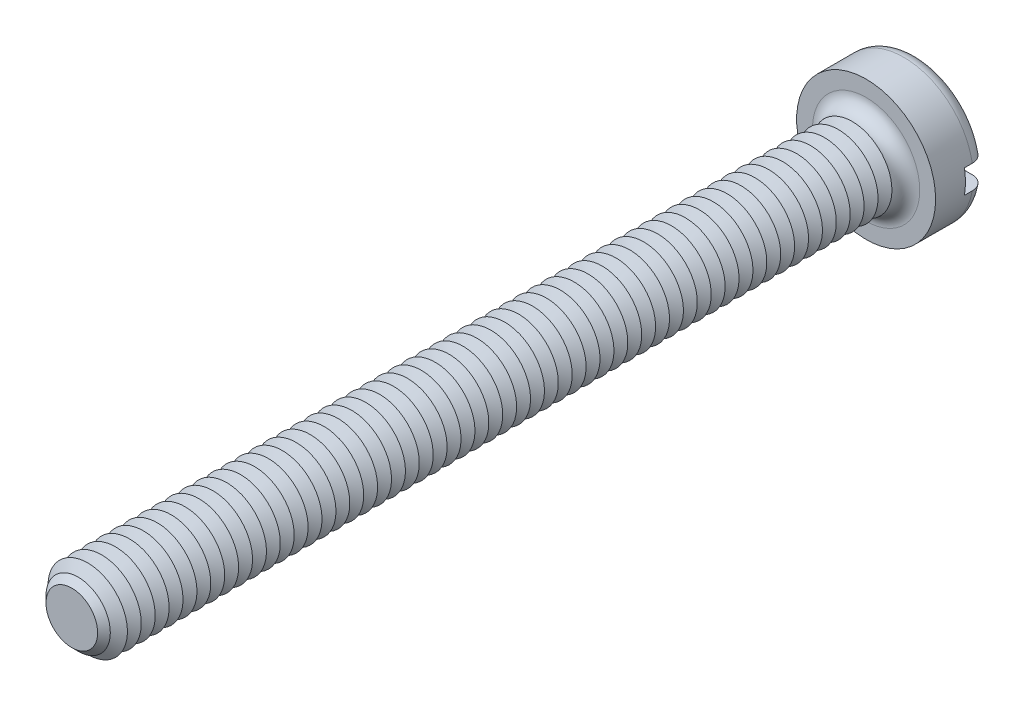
SolidWorks part; units mm, degrees
ref_plane "Front Plane" through (0, 0, 0) normal (0, 0, 1) x (1, 0, 0)
ref_plane "Top Plane" through (0, 0, 0) normal (0, 1, 0) x (1, 0, 0)
ref_plane "Right Plane" through (0, 0, 0) normal (1, 0, 0) x (0, 0, -1)
sketch "Sketch3" plane through (0, 0, 0) normal (0, 0, 1) x (1, 0, 0)
  circle A0 centre (0, 0) radius 3.5
  dimension "D1" = 7
extrude "Boss-Extrude2" add sketch "Sketch3" against normal blind 2.6
sketch "Sketch4" plane through (0, 0, 0) normal (0, 0, 1) x (1, 0, 0)
  circle A0 centre (0, 0) radius 2
  dimension "D1" = 4
extrude "Boss-Extrude3" add sketch "Sketch4" along normal blind 40
fillet "Fillet1" radius 0.7 2 edges at (3.5, 0, -2.6) (2, 0, 0)
chamfer "Chamfer1" distance 0.7 angle 45 1 edges at (2, 0, 40)
sketch "Sketch5" plane through (0, 0, 0) normal (1, 0, 0) x (0, 0, -1)
  line L0 (1.6944, 0) -> (-7.6738, 0) construction
sketch "Sketch6" plane through (0, 0, 0) normal (1, 0, 0) x (0, 0, -1)
  line L0 (-0.7, 2) -> (-1.05, 1.3938)
  line L1 (-1.05, 1.3938) -> (-1.4, 2)
  line L2 (-0.7, 2) -> (-39.3, 2) construction
  line L3 (-1.4, 2) -> (-0.7, 2)
  dimension "D1" = 0.7
revolve "Cut-Revolve1" cut sketch "Sketch6" angle 360 about L0
pattern_linear "LPattern1" count 56 spacing 0.7 along (0, 0, 1) of "Cut-Revolve1"
sketch "Sketch8" plane through (0, 0, -2.6) normal (0, 0, -1) x (-1, 0, 0)
  line L1 (3.5, -0.6) -> (-3.5, -0.6)
  line L2 (3.5, -0.6) -> (3.5, 0.6)
  line L3 (3.5, 0.6) -> (-3.5, 0.6)
  line L4 (-3.5, -0.6) -> (-3.5, 0.6)
  line L5 (3.5, -0.6) -> (-3.5, 0.6) construction
  line L6 (3.5, 0.6) -> (-3.5, -0.6) construction
  point P0 (0, 0)
  dimension "D1" = 7
  dimension "D2" = 1.2
extrude "Cut-Extrude1" cut sketch "Sketch8" against normal blind 1.1
